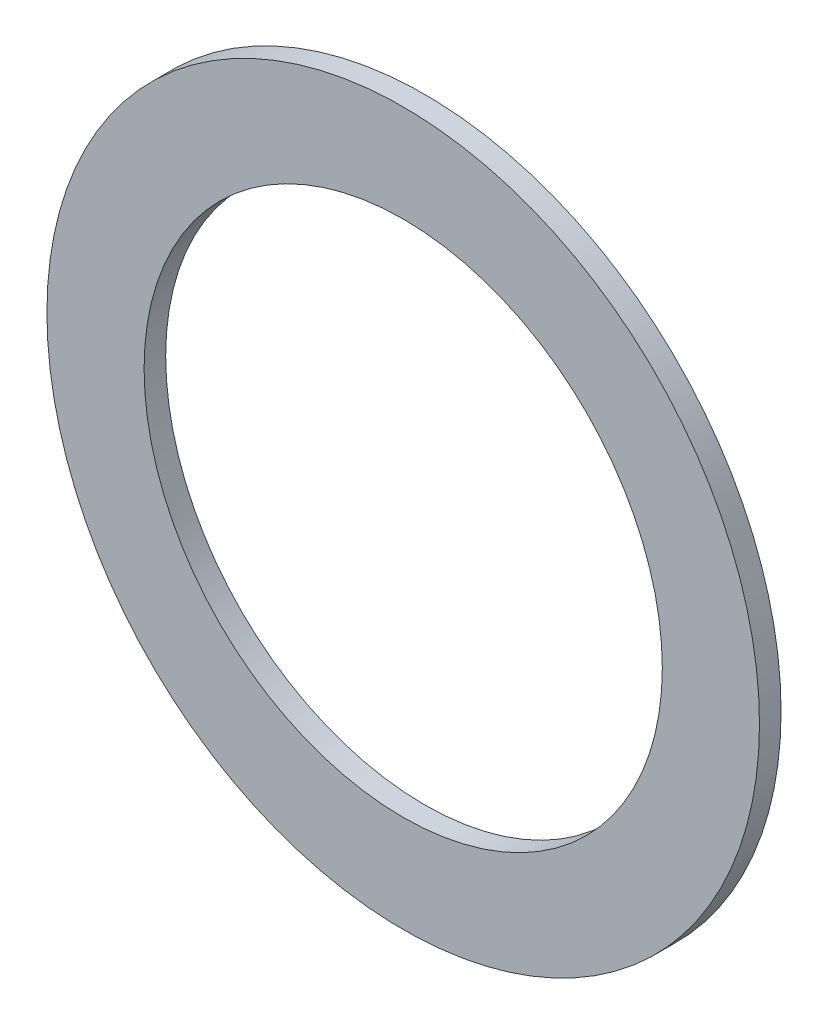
SolidWorks part; units mm, degrees
ref_plane "Ön Düzlem" through (0, 0, 0) normal (0, 0, 1) x (1, 0, 0)
ref_plane "Üst Düzlem" through (0, 0, 0) normal (0, 1, 0) x (1, 0, 0)
ref_plane "Sağ Düzlem" through (0, 0, 0) normal (1, 0, 0) x (0, 0, -1)
sketch "Sketch1" plane through (0, 0, 0) normal (0, 0, 1) x (1, 0, 0)
  circle A0 centre (0, 0) radius 12
  circle A1 centre (0, 0) radius 16.5
  dimension "D1" = 24
  dimension "D2" = 33
extrude "Boss-Extrude1" add sketch "Sketch1" along normal blind 1
